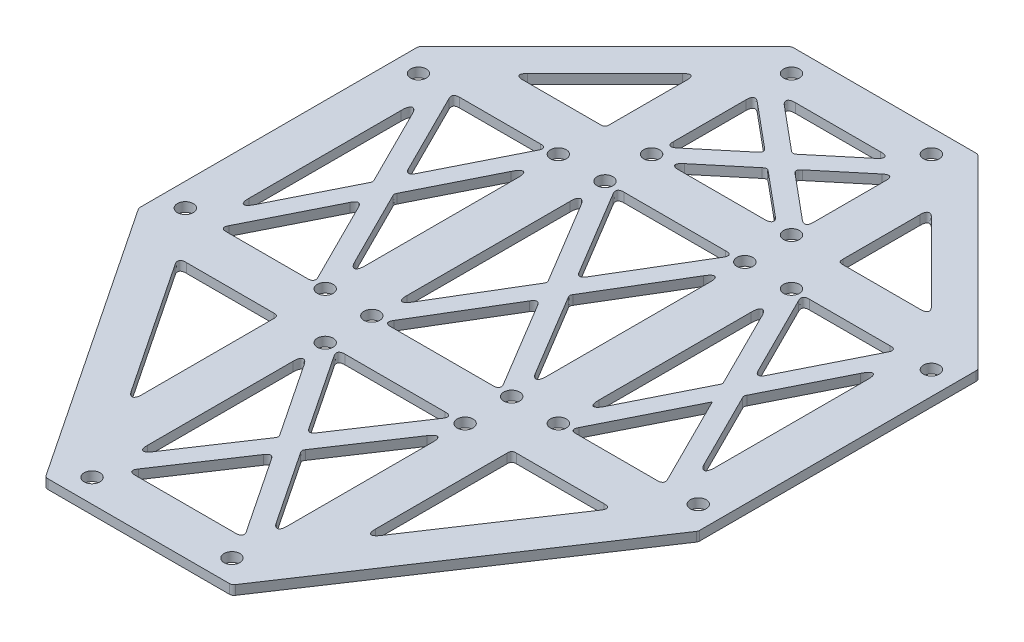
SolidWorks part; units mm, degrees
ref_plane "Front Plane" through (0, 0, 0) normal (0, 0, 1) x (1, 0, 0)
ref_plane "Top Plane" through (0, 0, 0) normal (0, 1, 0) x (1, 0, 0)
ref_plane "Right Plane" through (0, 0, 0) normal (1, 0, 0) x (0, 0, -1)
sketch "Sketch1" plane through (0, 0, 0) normal (0, 1, 0) x (1, 0, 0)
  line L1 (-76.2, 101.6) -> (76.2, 101.6)
  line L2 (-76.2, 101.6) -> (-76.2, -101.6)
  line L3 (-76.2, -101.6) -> (76.2, -101.6)
  line L4 (76.2, 101.6) -> (76.2, -101.6)
  line L5 (-76.2, 101.6) -> (76.2, -101.6) construction
  line L6 (-76.2, -101.6) -> (76.2, 101.6) construction
  point P0 (0, 0)
  dimension "D1" = 203.2
  dimension "D2" = 152.4
extrude "Boss-Extrude1" add sketch "Sketch1" along normal blind 2.54
sketch "Sketch2" plane through (0, 2.54, 0) normal (0, 1, 0) x (1, 0, 0)
  line L0 (-25.4, 101.6) -> (-76.2, 50.8)
  line L1 (76.2, 101.6) -> (-76.2, 101.6) construction
  line L2 (-76.2, 101.6) -> (-76.2, -101.6) construction
  line L3 (-25.4, -101.6) -> (-76.2, -25.4)
  line L4 (-76.2, -101.6) -> (76.2, -101.6) construction
  line L5 (0, 166.7461) -> (0, -166.7461) construction
  line L6 (-76.2, -25.4) -> (-82.8285, -25.4)
  line L7 (-82.8285, -25.4) -> (-82.8285, -107.7389)
  line L8 (-82.8285, -107.7389) -> (-25.4, -107.7389)
  line L9 (-25.4, -107.7389) -> (-25.4, -101.6)
  line L10 (-76.2, 50.8) -> (-82.8285, 50.8)
  line L11 (-82.8285, 50.8) -> (-82.8285, 107.9788)
  line L12 (-82.8285, 107.9788) -> (-25.4, 107.9788)
  line L13 (-25.4, 107.9788) -> (-25.4, 101.6)
  line L14 (82.8285, -107.7389) -> (25.4, -107.7389)
  line L15 (82.8285, -25.4) -> (82.8285, -107.7389)
  line L16 (76.2, -25.4) -> (82.8285, -25.4)
  line L17 (25.4, -101.6) -> (76.2, -25.4)
  line L18 (25.4, -107.7389) -> (25.4, -101.6)
  line L19 (82.8285, 107.9788) -> (25.4, 107.9788)
  line L20 (82.8285, 50.8) -> (82.8285, 107.9788)
  line L21 (76.2, 50.8) -> (82.8285, 50.8)
  line L22 (25.4, 101.6) -> (76.2, 50.8)
  line L23 (25.4, 107.9788) -> (25.4, 101.6)
  point P6 (0, 101.6)
  point P15 (0, 0)
  dimension "D1" = 25.4
  dimension "D2" = 50.8
  dimension "D3" = 25.4
  dimension "D4" = 76.2
extrude "Cut-Extrude1" cut sketch "Sketch2" against normal through all
sketch "Sketch3" plane through (0, 2.54, 0) normal (0, 1, 0) x (1, 0, 0)
  line L0 (0, 101.6) -> (0, -101.6) construction
  line L1 (-25.4, -101.6) -> (25.4, -101.6) construction
  line L2 (-76.2, 50.8) -> (76.2, 50.8) construction
  line L3 (-76.2, -25.4) -> (76.2, -25.4) construction
  line L4 (-63.5, 44.45) -> (-63.5, -19.05)
  line L5 (-76.2, 50.8) -> (-76.2, -25.4) construction
  line L6 (19.05, -88.9) -> (-19.05, -88.9)
  line L8 (-59.2667, -31.75) -> (-31.75, -73.025)
  line L9 (-25.4, -101.6) -> (-25.4, 101.6) construction
  line L10 (25.4, 101.6) -> (-25.4, 101.6) construction
  line L11 (-31.75, -73.025) -> (-31.75, -31.75)
  line L12 (-76.2, 50.8) -> (-25.4, 101.6) construction
  line L13 (-19.05, 88.9) -> (-19.05, 57.15)
  line L14 (-25.4, -101.6) -> (-76.2, -25.4) construction
  line L15 (-59.2667, -31.75) -> (-31.75, -31.75)
  line L16 (-63.5, -19.05) -> (-31.75, -19.05)
  line L17 (-57.15, 57.15) -> (-31.75, 82.55)
  line L18 (-19.05, 88.9) -> (19.05, 88.9)
  line L19 (-63.5, 44.45) -> (-31.75, 44.45)
  line L20 (-57.15, 57.15) -> (-31.75, 57.15)
  line L21 (-31.75, 57.15) -> (-31.75, 82.55)
  line L22 (-19.05, 44.45) -> (-19.05, -19.05)
  line L23 (-19.05, 44.45) -> (19.05, 44.45)
  line L24 (-19.05, -19.05) -> (19.05, -19.05)
  line L25 (-31.75, -19.05) -> (-31.75, 44.45)
  line L26 (-19.05, -31.75) -> (-19.05, -88.9)
  line L27 (-19.05, 57.15) -> (19.05, 57.15)
  line L28 (-19.05, -31.75) -> (19.05, -31.75)
  line L29 (19.05, 88.9) -> (19.05, 57.15)
  line L30 (19.05, 44.45) -> (19.05, -19.05)
  line L31 (19.05, -31.75) -> (19.05, -88.9)
  line L32 (59.2667, -31.75) -> (31.75, -31.75)
  line L33 (31.75, -73.025) -> (31.75, -31.75)
  line L34 (59.2667, -31.75) -> (31.75, -73.025)
  line L35 (57.15, 57.15) -> (31.75, 82.55)
  line L36 (31.75, 57.15) -> (31.75, 82.55)
  line L37 (57.15, 57.15) -> (31.75, 57.15)
  line L38 (63.5, 44.45) -> (31.75, 44.45)
  line L39 (31.75, -19.05) -> (31.75, 44.45)
  line L40 (63.5, -19.05) -> (31.75, -19.05)
  line L41 (63.5, 44.45) -> (63.5, -19.05)
  point P6 (0, 0)
  point P16 (0, 88.9)
  point P29 (0, 57.15)
  point P39 (0, 44.45)
  point P43 (0, -19.05)
  point P48 (0, -88.9)
  point P53 (0, -31.75)
  dimension "D1" = 12.7
  dimension "D2" = 25.4
  dimension "D3" = 6.35
  dimension "D4" = 6.35
  dimension "D5" = 12.7
  dimension "D6" = 12.7
  dimension "D7" = 6.35
  dimension "D8" = 12.7
  dimension "D9" = 12.7
  dimension "D10" = 6.35
extrude "Cut-Extrude2" cut sketch "Sketch3" against normal through all
sketch "Sketch4" plane through (0, 0, 0) normal (0, 1, 0) x (1, 0, 0)
  line L0 (-31.75, 44.45) -> (-63.5, -19.05) construction
  line L1 (-63.5, 44.45) -> (-31.75, -19.05) construction
  line L2 (-19.05, 88.9) -> (19.05, 57.15) construction
  line L3 (-19.05, 57.15) -> (19.05, 88.9) construction
  line L4 (-19.05, 44.45) -> (19.05, -19.05) construction
  line L5 (-19.05, -19.05) -> (19.05, 44.45) construction
  line L6 (-19.05, -31.75) -> (19.05, -88.9) construction
  line L7 (-19.05, -88.9) -> (19.05, -31.75) construction
  line L8 (0, -101.6) -> (0, 101.6) construction
  line L9 (-25.4, -101.6) -> (25.4, -101.6) construction
  line L10 (25.4, 101.6) -> (-25.4, 101.6) construction
  line L11 (-19.05, -14.1131) -> (-2.9621, 12.7)
  line L12 (-19.05, 44.45) -> (-19.05, -19.05) construction
  line L13 (-2.9621, 12.7) -> (-19.05, 39.5131)
  line L14 (0, 12.7) -> (-2.9621, 12.7) construction
  line L15 (-63.5, 44.45) -> (-63.5, -19.05) construction
  line L16 (-16.0879, 44.45) -> (0, 17.6369)
  line L17 (19.05, 44.45) -> (-19.05, 44.45) construction
  line L18 (-16.0879, -19.05) -> (0, 7.7631)
  line L19 (-19.05, -19.05) -> (19.05, -19.05) construction
  line L20 (-15.0824, 57.15) -> (0, 69.7187)
  line L21 (-19.05, 57.15) -> (19.05, 57.15) construction
  line L22 (-19.05, 60.4563) -> (-3.9676, 73.025)
  line L23 (-19.05, 88.9) -> (-19.05, 57.15) construction
  line L24 (0, 73.025) -> (-19.05, 73.025) construction
  line L25 (-3.9676, 73.025) -> (-19.05, 85.5937)
  line L26 (-15.0824, 88.9) -> (0, 76.3313)
  line L27 (19.05, 88.9) -> (-19.05, 88.9) construction
  line L28 (0, -60.325) -> (-19.05, -60.325) construction
  line L29 (-19.05, -31.75) -> (-19.05, -88.9) construction
  line L30 (-3.0527, -60.325) -> (-19.05, -36.3291)
  line L31 (-15.9973, -31.75) -> (0, -55.7459)
  line L32 (19.05, -31.75) -> (-19.05, -31.75) construction
  line L33 (-3.0527, -60.325) -> (-19.05, -84.3209)
  line L34 (-15.9973, -88.9) -> (0, -64.9041)
  line L35 (-19.05, -88.9) -> (19.05, -88.9) construction
  line L36 (-19.05, -36.3291) -> (-19.05, -31.75)
  line L37 (-19.05, -31.75) -> (-15.9973, -31.75)
  line L38 (-19.05, -84.3209) -> (-19.05, -88.9)
  line L39 (-19.05, -88.9) -> (-15.9973, -88.9)
  line L40 (-19.05, -14.1131) -> (-19.05, -19.05)
  line L41 (-19.05, -19.05) -> (-16.0879, -19.05)
  line L42 (-19.05, 39.5131) -> (-19.05, 44.45)
  line L43 (-19.05, 44.45) -> (-16.0879, 44.45)
  line L44 (-19.05, 60.4563) -> (-19.05, 57.15)
  line L45 (-19.05, 57.15) -> (-15.0824, 57.15)
  line L46 (-19.05, 85.5937) -> (-19.05, 88.9)
  line L47 (-19.05, 88.9) -> (-15.0824, 88.9)
  line L48 (-60.6602, 44.45) -> (-47.625, 18.3796)
  line L49 (-31.75, 44.45) -> (-63.5, 44.45) construction
  line L50 (-31.75, -19.05) -> (-31.75, 44.45) construction
  line L51 (-34.5898, 44.45) -> (-47.625, 18.3796)
  line L52 (-60.6602, -19.05) -> (-47.625, 7.0204)
  line L53 (-63.5, -19.05) -> (-31.75, -19.05) construction
  line L54 (-63.5, 38.7704) -> (-50.4648, 12.7)
  line L55 (-47.625, 7.0204) -> (-34.5898, -19.05)
  line L56 (-44.7852, 12.7) -> (-31.75, 38.7704)
  line L57 (-50.4648, 12.7) -> (-63.5, -13.3704)
  line L58 (-44.7852, 12.7) -> (-31.75, -13.3704)
  line L59 (-34.5898, -19.05) -> (-31.75, -19.05)
  line L60 (-31.75, -19.05) -> (-31.75, -13.3704)
  line L61 (-63.5, -13.3704) -> (-63.5, -19.05)
  line L62 (-63.5, -19.05) -> (-60.6602, -19.05)
  line L63 (-63.5, 38.7704) -> (-63.5, 44.45)
  line L64 (-63.5, 44.45) -> (-60.6602, 44.45)
  line L65 (-34.5898, 44.45) -> (-31.75, 44.45)
  line L66 (-31.75, 44.45) -> (-31.75, 38.7704)
  line L67 (44.7852, 12.7) -> (31.75, 38.7704)
  line L68 (31.75, 44.45) -> (31.75, 38.7704)
  line L69 (34.5898, 44.45) -> (31.75, 44.45)
  line L70 (34.5898, 44.45) -> (47.625, 18.3796)
  line L71 (60.6602, 44.45) -> (47.625, 18.3796)
  line L72 (63.5, 44.45) -> (60.6602, 44.45)
  line L73 (63.5, 38.7704) -> (63.5, 44.45)
  line L74 (63.5, 38.7704) -> (50.4648, 12.7)
  line L75 (50.4648, 12.7) -> (63.5, -13.3704)
  line L76 (63.5, -13.3704) -> (63.5, -19.05)
  line L77 (63.5, -19.05) -> (60.6602, -19.05)
  line L78 (60.6602, -19.05) -> (47.625, 7.0204)
  line L79 (47.625, 7.0204) -> (34.5898, -19.05)
  line L80 (34.5898, -19.05) -> (31.75, -19.05)
  line L81 (31.75, -19.05) -> (31.75, -13.3704)
  line L82 (44.7852, 12.7) -> (31.75, -13.3704)
  line L83 (15.9973, -31.75) -> (0, -55.7459)
  line L84 (19.05, -31.75) -> (15.9973, -31.75)
  line L85 (19.05, -36.3291) -> (19.05, -31.75)
  line L86 (3.0527, -60.325) -> (19.05, -36.3291)
  line L87 (19.05, -88.9) -> (15.9973, -88.9)
  line L88 (19.05, -84.3209) -> (19.05, -88.9)
  line L89 (3.0527, -60.325) -> (19.05, -84.3209)
  line L90 (15.9973, -88.9) -> (0, -64.9041)
  line L91 (15.0824, 57.15) -> (0, 69.7187)
  line L92 (19.05, 57.15) -> (15.0824, 57.15)
  line L93 (19.05, 60.4563) -> (19.05, 57.15)
  line L94 (19.05, 60.4563) -> (3.9676, 73.025)
  line L95 (3.9676, 73.025) -> (19.05, 85.5937)
  line L96 (15.0824, 88.9) -> (0, 76.3313)
  line L97 (19.05, 88.9) -> (15.0824, 88.9)
  line L98 (19.05, 85.5937) -> (19.05, 88.9)
  line L99 (19.05, 44.45) -> (16.0879, 44.45)
  line L100 (19.05, 39.5131) -> (19.05, 44.45)
  line L101 (19.05, -14.1131) -> (19.05, -19.05)
  line L102 (19.05, -19.05) -> (16.0879, -19.05)
  line L103 (16.0879, -19.05) -> (0, 7.7631)
  line L104 (19.05, -14.1131) -> (2.9621, 12.7)
  line L105 (16.0879, 44.45) -> (0, 17.6369)
  line L106 (2.9621, 12.7) -> (19.05, 39.5131)
  dimension "D1" = 2.54
  dimension "D2" = 2.54
  dimension "D3" = 5.08
  dimension "D4" = 5.08
  dimension "D5" = 2.54
  dimension "D6" = 5.08
  dimension "D7" = 2.54
  dimension "D8" = 5.08
  dimension "D9" = 2.54
  dimension "D10" = 5.08
  dimension "D11" = 2.54
  dimension "D12" = 2.54
extrude "Boss-Extrude2" add sketch "Sketch4" along normal blind 2.54
sketch "Sketch6" plane through (0, 2.54, 0) normal (0, 1, 0) x (1, 0, 0)
  line L0 (0, 108.3147) -> (0, -108.3147) construction
  line L1 (0, -31.75) -> (-19.05, -31.75) construction
  line L2 (-16.0879, -19.05) -> (16.0879, -19.05) construction
  line L3 (0, 44.45) -> (-19.05, 44.45) construction
  line L5 (-15.0824, 57.15) -> (15.0824, 57.15) construction
  circle A0 centre (-19.05, -31.75) radius 2.159
  circle A3 centre (19.05, -31.75) radius 2.159
  circle A4 centre (-19.05, 44.45) radius 2.159
  circle A7 centre (19.05, 44.45) radius 2.159
  circle A10 centre (-19.05, -95.25) radius 2.159
  circle A11 centre (19.05, -95.25) radius 2.159
  circle A12 centre (-19.05, 95.25) radius 2.159
  circle A13 centre (19.05, 95.25) radius 2.159
  point P4 (0, 0)
  dimension "D3" = 4.318
  dimension "D7" = 4.318
  dimension "D1" = 19.05
  dimension "D2" = 12.7
  dimension "D4" = 2
  dimension "D5" = 19.05
  dimension "D6" = 12.7
  dimension "D8" = 2
extrude "Cut-Extrude3" cut sketch "Sketch6" against normal through all
fillet "Fillet1" radius 1.27 71 edges at (3.9676, 1.27, -73.025) (3.0527, 1.27, 60.325) (2.9621, 1.27, -12.7) (15.0824, 1.27, -57.15) (16.0879, 1.27, 19.05) (15.9973, 1.27, 88.9) (15.9973, 1.27, 31.75) (16.0879, 1.27, -44.45) (15.0824, 1.27, -88.9) (19.05, 1.27, -85.5937) (19.05, 1.27, -39.5131) (19.05, 1.27, 36.3291) (19.05, 1.27, -60.4563) (19.05, 1.27, 14.1131) (19.05, 1.27, 84.3209) (31.75, 1.27, 73.025) (31.75, 1.27, 31.75) (59.2667, 1.27, 31.75) (44.7852, 1.27, -12.7) (60.6602, 1.27, 19.05) (63.5, 1.27, 13.3704) (47.625, 1.27, -18.3796) (34.5898, 1.27, -44.45) (63.5, 1.27, -38.7704) (60.6602, 1.27, -44.45) (57.15, 1.27, -57.15) (31.75, 1.27, -57.15) (31.75, 1.27, -82.55) (-3.9676, 1.27, -73.025) (-3.0527, 1.27, 60.325) (-2.9621, 1.27, -12.7) (-44.7852, 1.27, -12.7) (-50.4648, 1.27, -12.7) (-34.5898, 1.27, 19.05) (-31.75, 1.27, 13.3704) (-31.75, 1.27, -57.15) (-57.15, 1.27, -57.15) (-60.6602, 1.27, -44.45) (-59.2667, 1.27, 31.75) (-60.6602, 1.27, 19.05) (-31.75, 1.27, 73.025) (-19.05, 1.27, 14.1131) (-19.05, 1.27, -85.5937) (-19.05, 1.27, -39.5131) (-19.05, 1.27, 36.3291) (-19.05, 1.27, 84.3209) (-47.625, 1.27, -7.0204) (-31.75, 1.27, -82.55) (-31.75, 1.27, -38.7704) (-31.75, 1.27, 31.75) (31.75, 1.27, -38.7704) (31.75, 1.27, 13.3704) (0, 1.27, -69.7187) (0, 1.27, -7.7631) (0, 1.27, 64.9041) (0, 1.27, 55.7459) (0, 1.27, -17.6369) (0, 1.27, -76.3313) (-47.625, 1.27, -18.3796) (-19.05, 1.27, -60.4563) (-15.0824, 1.27, -57.15) (-15.0824, 1.27, -88.9) (-16.0879, 1.27, -44.45) (-15.9973, 1.27, 31.75) (50.4648, 1.27, -12.7) (-63.5, 1.27, 13.3704) (-15.9973, 1.27, 88.9) (-16.0879, 1.27, 19.05) (-63.5, 1.27, -38.7704) (34.5898, 1.27, 19.05) (-34.5898, 1.27, -44.45)
sketch "Sketch7" plane through (0, 2.54, 0) normal (0, 1, 0) x (1, 0, 0)
  line L0 (-19.05, -31.75) -> (-19.05, -19.05) construction
  line L1 (0, -37.3154) -> (0, 62.9762) construction
  line L2 (-19.05, 44.45) -> (-19.05, 57.15) construction
  line L3 (-19.05, -19.05) -> (-31.75, -19.05) construction
  line L4 (-19.05, -19.05) -> (-69.85, -19.05) construction
  line L5 (-19.05, 44.45) -> (-69.85, 44.45) construction
  circle A0 centre (-19.05, -19.05) radius 2.159
  circle A1 centre (-19.05, 57.15) radius 2.159
  circle A2 centre (19.05, -19.05) radius 2.159
  circle A3 centre (19.05, 57.15) radius 2.159
  circle A4 centre (-31.75, -19.05) radius 2.159
  circle A5 centre (-69.85, -19.05) radius 2.159
  circle A6 centre (-69.85, 44.45) radius 2.159
  circle A7 centre (-31.75, 44.45) radius 2.159
  circle A8 centre (69.85, -19.05) radius 2.159
  circle A9 centre (31.75, -19.05) radius 2.159
  circle A10 centre (69.85, 44.45) radius 2.159
  circle A11 centre (31.75, 44.45) radius 2.159
  dimension "D2" = 4.318
  dimension "D3" = 4.318
  dimension "D1" = 12.7
  dimension "D4" = 12.7
  dimension "D5" = 12.7
  dimension "D6" = 50.8
extrude "Cut-Extrude4" cut sketch "Sketch7" against normal through all
fillet "Fillet2" radius 1.27 8 edges at (25.4, 1.27, -101.6) (76.2, 1.27, -50.8) (76.2, 1.27, 25.4) (25.4, 1.27, 101.6) (-25.4, 1.27, 101.6) (-76.2, 1.27, 25.4) (-76.2, 1.27, -50.8) (-25.4, 1.27, -101.6)
